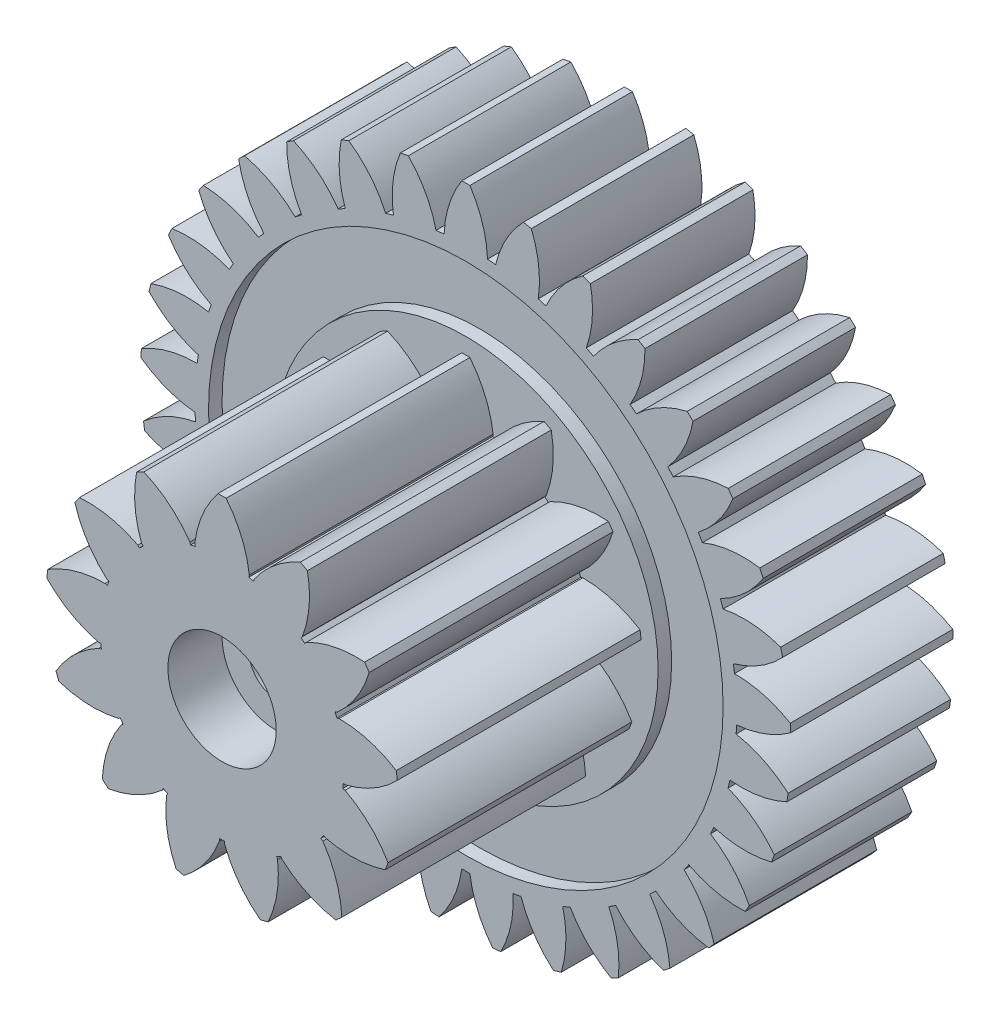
SolidWorks part; units mm, degrees
ref_plane "Plan1" through (0, 0, 0) normal (0, 0, 1) x (1, 0, 0)
ref_plane "Plan2" through (0, 0, 0) normal (0, 1, 0) x (1, 0, 0)
ref_plane "Plan3" through (0, 0, 0) normal (1, 0, 0) x (0, 0, -1)
sketch "Esquisse1" plane through (0, 0, 0) normal (0, 0, 1) x (1, 0, 0)
  circle A0 centre (0, 0) radius 12
  dimension "D1" = 24
extrude "Base-Extrusion" add sketch "Esquisse1" along normal blind 6
sketch "Esquisse2" plane through (0, 0, 6) normal (0, 0, 1) x (1, 0, 0)
  circle A0 centre (0, 0) radius 6.5
  dimension "D1" = 13
extrude "Boss.-Extru.1" add sketch "Esquisse2" along normal blind 9
sketch "Esquisse3" plane through (0, 0, 15) normal (0, 0, 1) x (1, 0, 0)
  line L0 (0, 0) -> (0, 7) construction
  line L1 (0, 0) -> (1.6369, 6.1091) construction
  line L2 (0, 0) -> (3.5355, 6.1237) construction
  line L3 (1.1647, 4.3467) -> (2.3008, 8.5866)
  line L4 (-1.1647, 4.3467) -> (-2.3008, 8.5866)
  line L5 (2.3008, 8.5866) -> (-2.3008, 8.5866)
  circle A0 centre (0, 0) radius 4.5 construction
  circle A1 centre (0, 0) radius 6.5 construction
  arc A2 (0.15, 6.4983) -> (1.0176, 4.3834) centre (-2.9627, 3.986) cw
  circle A3 centre (0, 0) radius 6.5 construction
  arc A4 (-1.0176, 4.3834) -> (-1.1647, 4.3467) centre (0, 0) ccw
  arc A5 (-0.15, 6.4983) -> (0.15, 6.4983) centre (0, 0) cw
  arc A6 (1.0176, 4.3834) -> (1.1647, 4.3467) centre (0, 0) cw
  arc A7 (-0.15, 6.4983) -> (-1.0176, 4.3834) centre (2.9627, 3.986) ccw
  dimension "D1" = 13
  dimension "D2" = 9
  dimension "D7" = 4
  dimension "D3" = 15
  dimension "D4" = 30
  dimension "D5" = 0.15
  dimension "D6" = 0.1516
extrude "Enlèv. mat.-Extru.1" cut sketch "Esquisse3" against normal up to surface (9 mm away)
pattern_circular "Répétition circulaire1" count 13 every 27.692 about axis through (0, 0, 0) along (0, 0, 1) of "Enlèv. mat.-Extru.1"
sketch "Esquisse4" plane through (0, 0, 6) normal (0, 0, 1) x (1, 0, 0)
  line L0 (0, 0) -> (0, 13.9994) construction
  line L1 (0, 0) -> (1.3609, 14.2524) construction
  line L2 (0, 0) -> (2.7941, 14.4974) construction
  line L3 (0.9506, 9.9547) -> (1.4258, 14.9315)
  line L4 (-0.9506, 9.9547) -> (-1.4258, 14.9315)
  line L5 (1.4258, 14.9315) -> (-1.4258, 14.9315)
  circle A0 centre (0, 0) radius 12 construction
  circle A1 centre (0, 0) radius 10 construction
  arc A2 (-0.8011, 9.9679) -> (-0.9506, 9.9547) centre (0, 0) ccw
  arc A3 (-0.15, 11.9991) -> (0.15, 11.9991) centre (0, 0) cw
  arc A4 (0.15, 11.9991) -> (0.8011, 9.9679) centre (-3.1956, 9.8066) cw
  arc A7 (-0.15, 11.9991) -> (-0.8011, 9.9679) centre (3.1956, 9.8066) ccw
  arc A8 (0.8011, 9.9679) -> (0.9506, 9.9547) centre (0, 0) cw
  dimension "D1" = 20
  dimension "D2" = 24
  dimension "D7" = 4
  dimension "D3" = 5.455
  dimension "D4" = 10.909
  dimension "D5" = 0.15
  dimension "D6" = 0.15
extrude "Enlèv. mat.-Extru.2" cut sketch "Esquisse4" against normal through all
pattern_circular "Répétition circulaire2" count 33 every 10.909 about axis through (0, 0, 0) along (0, 0, 1) of "Enlèv. mat.-Extru.2"
sketch "Esquisse5" plane through (0, 0, 15) normal (0, 0, 1) x (1, 0, 0)
  circle A0 centre (0, 0) radius 1
  dimension "D1" = 2
extrude "Enlèv. mat.-Extru.3" cut sketch "Esquisse5" against normal through all
sketch "Esquisse6" plane through (0, 0, 0) normal (0, 0, -1) x (-1, 0, 0)
  circle A0 centre (0, 0) radius 1
  circle A1 centre (0, 0) radius 1 construction
  circle A2 centre (0, 0) radius 2.25
  dimension "D1" = 4.5
extrude "Extrusion1" add sketch "Esquisse6" along normal blind 0.5
sketch "Esquisse7" plane through (0, 0, 6) normal (0, 0, 1) x (1, 0, 0)
  circle A0 centre (0, 0) radius 7.1
  circle A1 centre (0, 0) radius 9.5
  dimension "D1" = 14.2
  dimension "D2" = 19
extrude "Enlèv. mat.-Extru.4" cut sketch "Esquisse7" against normal blind 0.5
sketch "Esquisse9" plane through (0, 0, 15) normal (0, 0, 1) x (1, 0, 0)
  circle A0 centre (0, 0) radius 2
  dimension "D1" = 4
extrude "Enlèv. mat.-Extru.5" cut sketch "Esquisse9" against normal blind 2
